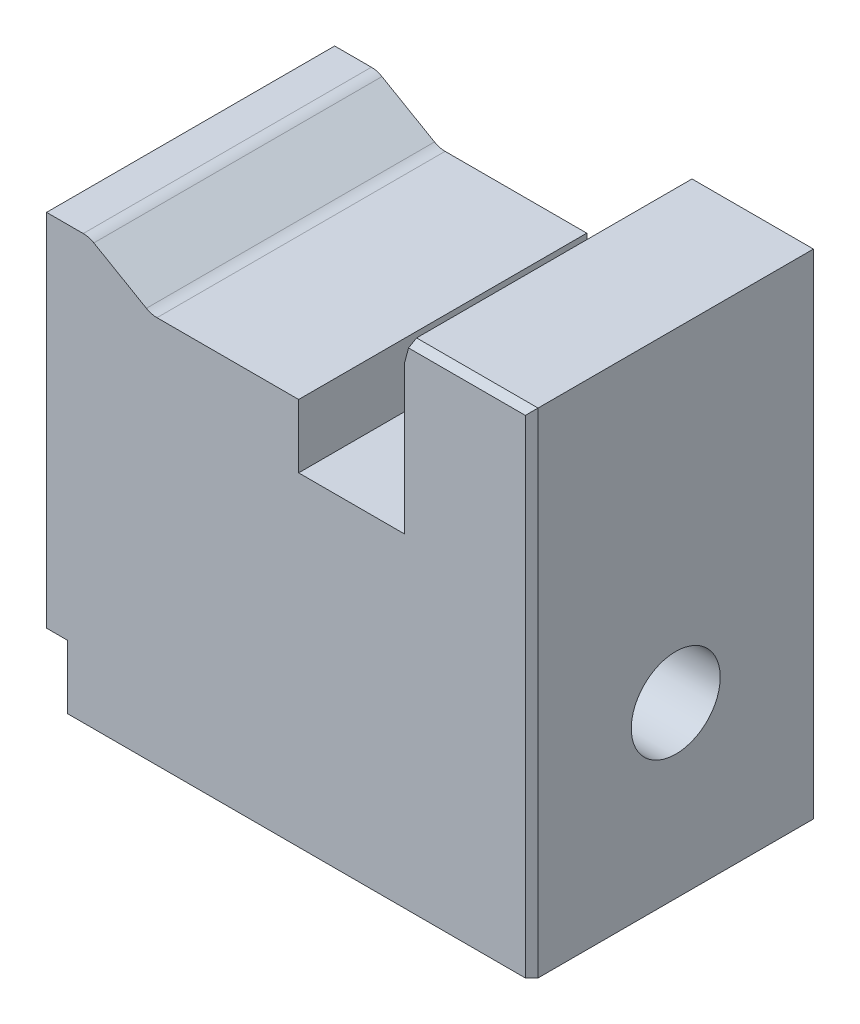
SolidWorks part; units mm, degrees
ref_plane "前视基准面" through (0, 0, 0) normal (0, 0, 1) x (1, 0, 0)
ref_plane "上视基准面" through (0, 0, 0) normal (0, 1, 0) x (1, 0, 0)
ref_plane "右视基准面" through (0, 0, 0) normal (1, 0, 0) x (0, 0, -1)
sketch "草图1" plane through (0, 0, 0) normal (0, 0, 1) x (1, 0, 0)
  line L0 (0, 0) -> (22.9, 0)
  line L1 (22.9, 0) -> (22.9, 23.3)
  line L2 (2.2321, 19.866) -> (4.7124, 18.434)
  line L3 (5.2124, 18.3) -> (11.9, 18.3)
  line L4 (1.7321, 20) -> (0, 20)
  line L5 (0, 20) -> (0, 0)
  line L6 (11.9, 18.3) -> (11.9, 15.3)
  line L7 (16.9, 15.3) -> (16.9, 23.3)
  line L8 (16.9, 23.3) -> (22.9, 23.3)
  line L9 (11.9, 15.3) -> (16.9, 15.3)
  arc A0 (1.7321, 20) -> (2.2321, 19.866) centre (1.7321, 19) cw
  arc A1 (5.2124, 18.3) -> (4.7124, 18.434) centre (5.2124, 19.3) cw
  point P10 (2, 20)
  dimension "D6" = 1
  dimension "D1" = 2
  dimension "D2" = 22.9
  dimension "D3" = 5
  dimension "D4" = 1.7
  dimension "D5" = 20
  dimension "D7" = 30
  dimension "D8" = 6
  dimension "D9" = 5
  dimension "D10" = 8
extrude "凸台-拉伸1" add sketch "草图1" along normal blind 13.6
hole_wizard "M5x0.8 螺纹孔1" positions "草图7" profile "草图6" tap size "M5x0.8" standard "Ansi Metric"
sketch "草图7" plane through (22.9, 0, 0) normal (1, 0, 0) x (0, 0, -1)
  line L0 (-6.8, 0) -> (-6.8, 8) construction
  line L1 (-13.6, 0) -> (0, 0) construction
  point P0 (-6.8, 8)
  dimension "D1" = 8
sketch "草图6" plane through (22.9, 8, 6.8) normal (0, 1, 0) x (0, 0, -1)
  line L0 (0, 0) -> (0, 13.6618)
  line L1 (0, 13.6618) -> (2.1, 12.4)
  line L2 (2.1, 12.4) -> (2.1, 0)
  line L5 (2.1, 0) -> (0, 0)
  line L10 (0, 13.6618) -> (-2.1, 12.4) construction
  line L11 (0, -6.35) -> (0, 107.95) construction
  dimension "螺纹孔钻头直径" = 4.2
  dimension "螺纹孔钻头深度" = 12.4
  dimension "导头角度" = 118
chamfer "倒角1" distance 0.3 angle 45 4 edges at (19.9, 23.3, 0) (22.9, 11.65, 0) (19.9, 23.3, 13.6) (22.9, 11.65, 13.6)
chamfer "倒角2" distance 1 angle 15 1 edges at (16.9, 23.3, 6.8)
sketch "草图12" plane through (0, 0, 0) normal (-1, 0, 0) x (0, 0, 1)
  line L0 (13.6, 0) -> (0, 0) construction
  line L1 (-4.3574, 3) -> (17.264, 3)
  line L2 (-4.3574, 3) -> (-4.3574, -6.5178)
  line L3 (-4.3574, -6.5178) -> (17.264, -6.5178)
  line L4 (17.264, 3) -> (17.264, -6.5178)
  dimension "D1" = 3
extrude "切除-拉伸7" cut sketch "草图12" against normal blind 1
